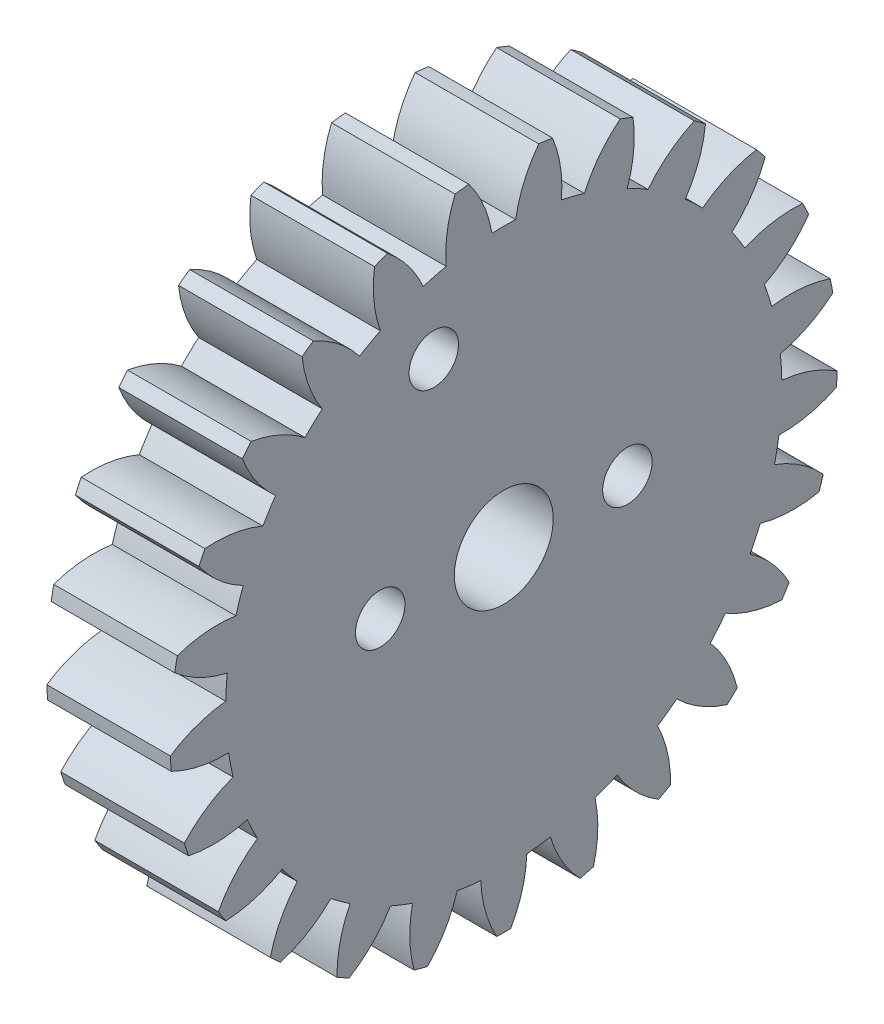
SolidWorks part; units mm, degrees
ref_plane "Front Plane" through (0, 0, 0) normal (0, 0, 1) x (1, 0, 0)
ref_plane "Top Plane" through (0, 0, 0) normal (0, 1, 0) x (1, 0, 0)
ref_plane "Right Plane" through (0, 0, 0) normal (1, 0, 0) x (0, 0, -1)
inserted part "spur gear_am<4>@tmpAssm"
sketch "Sketch1" plane through (-5.7393, 0, 0) normal (1, 0, 0) x (0, 0, -1)
  line L0 (-68.4192, 32.7252) -> (-59.3723, 32.7252) construction
  line L1 (-68.4192, 32.7252) -> (-70.6064, 38.9122) construction
  circle A0 centre (-71.2523, 40.7392) radius 1
  circle A1 centre (-63.4192, 32.7252) radius 1
  circle A2 centre (-73.4192, 32.7252) radius 1
  circle A3 centre (-68.4192, 32.7252) radius 2 construction
  dimension "D2" = 5
  dimension "D3" = 5
  dimension "D4" = 8.5
  dimension "D1" = 109.469
extrude "Cut-Extrude1" cut sketch "Sketch1" against normal blind 10
sketch "Sketch2" plane through (-5.7393, 0, 0) normal (1, 0, 0) x (0, 0, -1)
  line L0 (-68.4192, 32.7252) -> (-58.3671, 32.7252)
